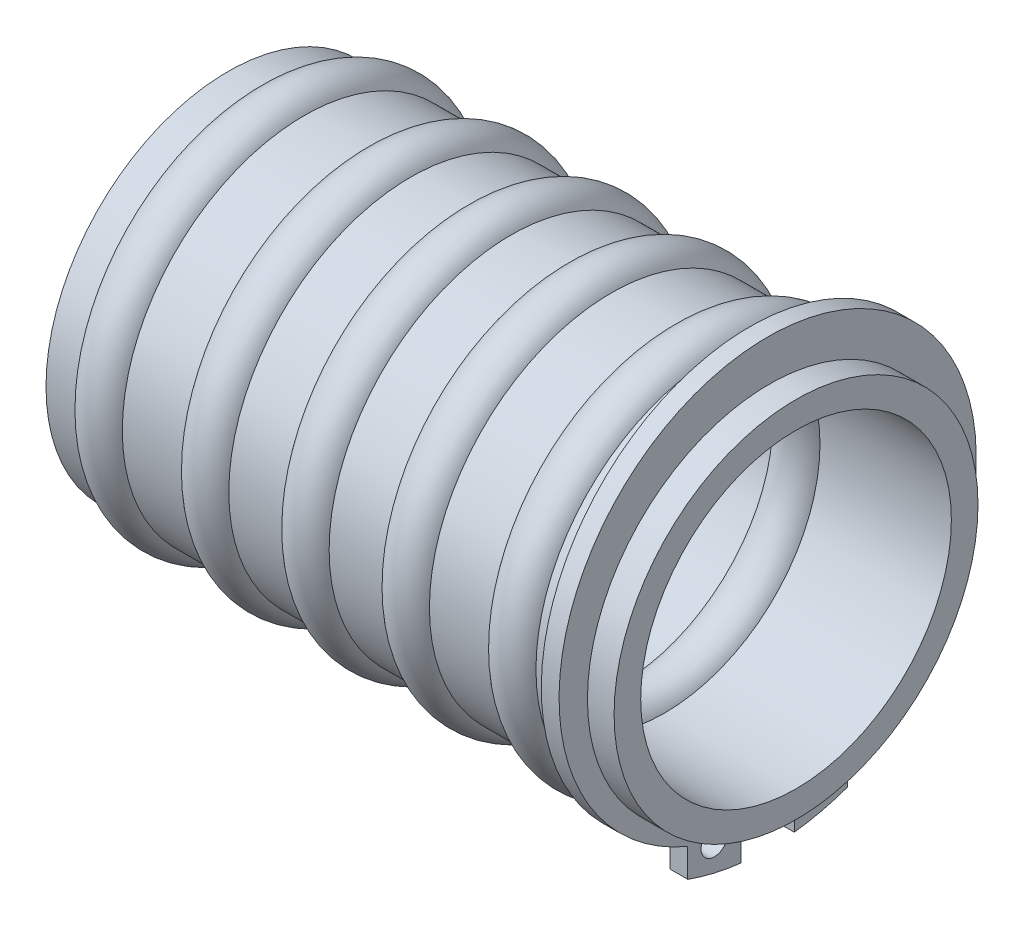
SolidWorks part; units mm, degrees
ref_plane "Plan de face" through (0, 0, 0) normal (0, 0, 1) x (1, 0, 0)
ref_plane "Plan de dessus" through (0, 0, 0) normal (0, 1, 0) x (1, 0, 0)
ref_plane "Plan de droite" through (0, 0, 0) normal (1, 0, 0) x (0, 0, -1)
sketch "Esquisse1" plane through (0, 0, 0) normal (0, 0, 1) x (1, 0, 0)
  line L0 (0, 8.75) -> (4.701, 8.75)
  line L1 (7.299, 8.75) -> (22.001, 8.75)
  line L2 (24.599, 8.75) -> (32, 8.75)
  line L3 (32, 8.75) -> (32, 10.25)
  line L4 (32, 10.25) -> (30.5, 10.25)
  line L5 (30.5, 10.25) -> (30.5, 9.5)
  line L6 (30.5, 9.5) -> (29.3, 9.5)
  line L7 (29.3, 9.5) -> (29.3, 10.25)
  line L8 (29.3, 10.25) -> (27.599, 10.25)
  line L9 (25.001, 10.25) -> (21.599, 10.25)
  line L10 (19.001, 10.25) -> (10.299, 10.25)
  line L11 (7.701, 10.25) -> (4.299, 10.25)
  line L12 (1.701, 10.25) -> (0, 10.25)
  line L13 (0, 10.25) -> (0, 8.75)
  line L14 (32, 0) -> (0, 0) construction
  arc A0 (4.701, 8.75) -> (7.299, 8.75) centre (6, 9.5) ccw
  arc A1 (22.001, 8.75) -> (24.599, 8.75) centre (23.3, 9.5) ccw
  arc A2 (27.599, 10.25) -> (25.001, 10.25) centre (26.3, 9.5) ccw
  arc A3 (21.599, 10.25) -> (19.001, 10.25) centre (20.3, 9.5) ccw
  arc A4 (10.299, 10.25) -> (7.701, 10.25) centre (9, 9.5) ccw
  arc A5 (4.299, 10.25) -> (1.701, 10.25) centre (3, 9.5) ccw
revolve "Révolution1" add sketch "Esquisse1" angle 360 about L14
sketch "Esquisse2" plane through (0, 0, 0) normal (0, 0, 1) x (1, 0, 0)
  line L0 (50, 0) -> (-50, 0) construction
  circle A0 centre (14.65, 9.5) radius 1.5
revolve "Révolution2" add sketch "Esquisse2" angle 360 about L0
ref_plane "Plan1" through (14.65, 0, 0) normal (1, 0, 0) x (0, 0, -1)
ref_plane "Plan2" through (29.3, 0, 0) normal (1, 0, 0) x (0, 0, -1)
ref_plane "Plan3" through (29.4, 0, 0) normal (1, 0, 0) x (0, 0, -1)
sketch "Esquisse3" plane through (29.4, 0, 0) normal (1, 0, 0) x (0, 0, -1)
  line L0 (-4.5, -10.1041) -> (-4.5, -11.7124)
  line L1 (-1.5, -12.4148) -> (-1.5, -9.1782)
  line L2 (1.5, -9.1782) -> (1.5, -12.4148)
  line L3 (4.5, -11.7124) -> (4.5, -10.1041)
  arc A0 (4.5, -10.1041) -> (-4.5, -10.1041) centre (0, 0.75) ccw
  arc A1 (-4.5, -11.7124) -> (-1.5, -12.4148) centre (0, 0.75) ccw
  arc A2 (-1.5, -9.1782) -> (1.5, -9.1782) centre (0, 0) cw
  arc A3 (1.5, -12.4148) -> (4.5, -11.7124) centre (0, 0.75) ccw
  circle A4 centre (3, -10.6106) radius 0.75
  circle A5 centre (-3, -10.6106) radius 0.75
extrude "Extrusion1" add sketch "Esquisse3" along normal blind 1
